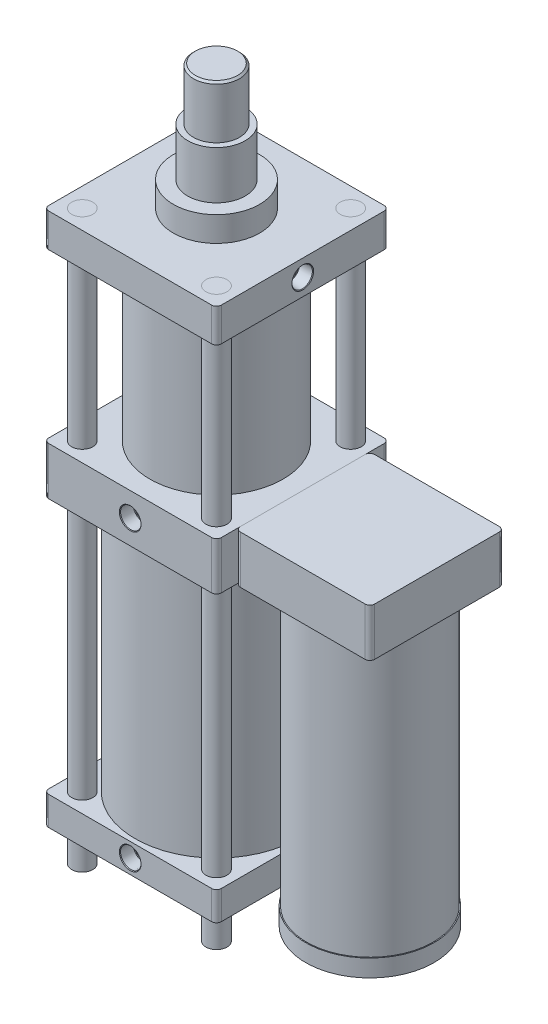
SolidWorks part; units mm, degrees
ref_plane "前视基准面" through (0, 0, 0) normal (0, 0, 1) x (1, 0, 0)
ref_plane "上视基准面" through (0, 0, 0) normal (0, 1, 0) x (1, 0, 0)
ref_plane "右视基准面" through (0, 0, 0) normal (1, 0, 0) x (0, 0, -1)
sketch "草图1" plane through (0, 0, 0) normal (0, 1, 0) x (1, 0, 0)
  line L0 (0, 0) -> (70, 0) construction
  line L1 (85, 90) -> (-85, 90)
  line L2 (90, 85) -> (90, -85)
  line L3 (85, -90) -> (-85, -90)
  line L4 (-90, 85) -> (-90, -85)
  line L5 (90, 90) -> (-90, -90) construction
  line L6 (90, -90) -> (-90, 90) construction
  line L7 (70, 0) -> (70, -70) construction
  circle A0 centre (70, -70) radius 11
  circle A1 centre (-70, -70) radius 11
  circle A2 centre (-70, 70) radius 11
  circle A3 centre (70, 70) radius 11
  arc A4 (-90, -85) -> (-85, -90) centre (-85, -85) ccw
  arc A5 (90, -85) -> (85, -90) centre (85, -85) cw
  arc A6 (85, 90) -> (90, 85) centre (85, 85) cw
  arc A7 (-90, 85) -> (-85, 90) centre (-85, 85) cw
  point P0 (0, 0)
  point P19 (0, 0)
  dimension "D3" = 4
  dimension "D4" = 5
  dimension "D1" = 180
  dimension "D2" = 180
extrude "凸台-拉伸1" add sketch "草图1" along normal blind 35
sketch "草图2" plane through (0, 35, 0) normal (0, 1, 0) x (1, 0, 0)
  circle A0 centre (0, 0) radius 45
extrude "凸台-拉伸2" add sketch "草图2" along normal blind 26
sketch "草图3" plane through (0, 61, 0) normal (0, 1, 0) x (1, 0, 0)
  circle A0 centre (0, 0) radius 30
extrude "凸台-拉伸3" add sketch "草图3" along normal blind 50
sketch "草图4" plane through (0, 111, 0) normal (0, 1, 0) x (1, 0, 0)
  circle A0 centre (0, 0) radius 24
extrude "凸台-拉伸4" add sketch "草图4" along normal blind 55
chamfer "倒角1" distance 2 angle 45 1 edges at (0, 166, 24)
sketch "草图5" plane through (0, 0, 0) normal (0, -1, 0) x (1, 0, 0)
  circle A0 centre (0, 0) radius 69.5
extrude "凸台-拉伸5" add sketch "草图5" along normal blind 175 separate body
sketch "草图6" plane through (0, -175, 0) normal (0, -1, 0) x (1, 0, 0)
  line L0 (85, -90) -> (-85, -90) construction
  line L1 (90, 85) -> (90, -85) construction
  line L2 (-90, -85) -> (-90, 85) construction
  line L3 (-85, 90) -> (85, 90) construction
  line L4 (85, -90) -> (-85, -90)
  line L5 (90, 85) -> (90, -85)
  line L6 (-90, -85) -> (-90, 85)
  line L7 (-85, 90) -> (85, 90)
  circle A0 centre (70, -70) radius 11 construction
  circle A1 centre (-70, -70) radius 11 construction
  arc A2 (-90, -85) -> (-85, -90) centre (-85, -85) ccw construction
  arc A3 (85, -90) -> (90, -85) centre (85, -85) ccw construction
  arc A4 (90, 85) -> (85, 90) centre (85, 85) ccw construction
  circle A5 centre (70, 70) radius 11 construction
  circle A6 centre (-70, 70) radius 11 construction
  arc A7 (-85, 90) -> (-90, 85) centre (-85, 85) ccw construction
  circle A8 centre (70, -70) radius 11
  circle A9 centre (-70, -70) radius 11
  arc A10 (-90, -85) -> (-85, -90) centre (-85, -85) ccw
  arc A11 (85, -90) -> (90, -85) centre (85, -85) ccw
  arc A12 (90, 85) -> (85, 90) centre (85, 85) ccw
  circle A13 centre (70, 70) radius 11
  circle A14 centre (-70, 70) radius 11
  arc A15 (-85, 90) -> (-90, 85) centre (-85, 85) ccw
extrude "凸台-拉伸6" add sketch "草图6" along normal blind 50
sketch "草图7" plane through (0, -225, 0) normal (0, -1, 0) x (1, 0, 0)
  circle A0 centre (0, 0) radius 85
extrude "凸台-拉伸7" add sketch "草图7" along normal blind 267
sketch "草图8" plane through (0, -492, 0) normal (0, -1, 0) x (1, 0, 0)
  line L0 (-85, -90) -> (85, -90) construction
  line L1 (90, -85) -> (90, 85) construction
  line L2 (85, 90) -> (-85, 90) construction
  line L3 (-90, 85) -> (-90, -85) construction
  line L4 (-85, -90) -> (85, -90)
  line L5 (90, -85) -> (90, 85)
  line L6 (85, 90) -> (-85, 90)
  line L7 (-90, 85) -> (-90, -85)
  circle A0 centre (-70, -70) radius 11 construction
  arc A1 (-90, -85) -> (-85, -90) centre (-85, -85) ccw construction
  circle A2 centre (70, -70) radius 11 construction
  arc A3 (85, -90) -> (90, -85) centre (85, -85) ccw construction
  arc A4 (90, 85) -> (85, 90) centre (85, 85) ccw construction
  circle A5 centre (70, 70) radius 11 construction
  arc A6 (-85, 90) -> (-90, 85) centre (-85, 85) ccw construction
  circle A7 centre (-70, 70) radius 11 construction
  circle A8 centre (-70, -70) radius 11
  arc A9 (-90, -85) -> (-85, -90) centre (-85, -85) ccw
  circle A10 centre (70, -70) radius 11
  arc A11 (85, -90) -> (90, -85) centre (85, -85) ccw
  arc A12 (90, 85) -> (85, 90) centre (85, 85) ccw
  circle A13 centre (70, 70) radius 11
  arc A14 (-85, 90) -> (-90, 85) centre (-85, 85) ccw
  circle A15 centre (-70, 70) radius 11
extrude "凸台-拉伸8" add sketch "草图8" along normal blind 30
sketch "草图9" plane through (0, -175, 0) normal (0, 1, 0) x (1, 0, 0)
  line L0 (90, 0) -> (160, 0) construction
  line L1 (90, 85) -> (90, -85) construction
  line L3 (225, -70) -> (95, -70)
  line L4 (230, -65) -> (230, 65)
  line L5 (225, 70) -> (95, 70)
  line L6 (90, -65) -> (90, 65)
  line L7 (230, -70) -> (90, 70) construction
  line L8 (230, 70) -> (90, -70) construction
  arc A0 (95, 70) -> (90, 65) centre (95, 65) ccw
  arc A1 (95, -70) -> (90, -65) centre (95, -65) cw
  arc A2 (230, -65) -> (225, -70) centre (225, -65) cw
  arc A3 (230, 65) -> (225, 70) centre (225, 65) ccw
  dimension "D3" = 5
  dimension "D1" = 140
  dimension "D2" = 140
extrude "凸台-拉伸9" add sketch "草图9" against normal up to surface (50 mm away) separate body
sketch "草图10" plane through (0, -225, 0) normal (0, -1, 0) x (1, 0, 0)
  line L0 (160, 70) -> (160, -70) construction
  line L1 (95, 70) -> (225, 70) construction
  circle A0 centre (160, 0) radius 66
extrude "凸台-拉伸10" add sketch "草图10" along normal blind 290 separate body
sketch "草图11" plane through (0, -515, 0) normal (0, -1, 0) x (1, 0, 0)
  circle A0 centre (160, 0) radius 67
extrude "凸台-拉伸11" add sketch "草图11" along normal blind 18 separate body
sketch "草图12" plane through (0, -533, 0) normal (0, -1, 0) x (1, 0, 0)
  line L1 (177.3205, 0) -> (168.6603, 15)
  line L2 (168.6603, 15) -> (151.3397, 15)
  line L3 (151.3397, 15) -> (142.6795, 0)
  line L4 (142.6795, 0) -> (151.3397, -15)
  line L5 (151.3397, -15) -> (168.6603, -15)
  line L6 (168.6603, -15) -> (177.3205, 0)
  circle A0 centre (160, 0) radius 15 construction
extrude "凸台-拉伸12" add sketch "草图12" along normal blind 12 separate body
sketch "草图13" plane through (0, -522, 0) normal (0, -1, 0) x (1, 0, 0)
  circle A0 centre (-70, -70) radius 11 construction
  circle A1 centre (-70, 70) radius 11 construction
  circle A2 centre (70, -70) radius 11 construction
  circle A3 centre (70, 70) radius 11 construction
  circle A4 centre (-70, -70) radius 11
  circle A5 centre (-70, 70) radius 11
  circle A6 centre (70, -70) radius 11
  circle A7 centre (70, 70) radius 11
extrude "凸台-拉伸13" add sketch "草图13" against normal up to surface (557 mm away) and the other way blind 35 separate body
hole_wizard "1/2 NPT 螺纹孔1" positions "草图14" profile "草图15" size "1/2" standard "ANSI Inch"
sketch "草图14" plane through (90, 0, 0) normal (1, 0, 0) x (0, 0, -1)
  line L0 (-85, 35) -> (85, 35) construction
  point P0 (0, 17.5)
  dimension "D1" = 17.5
sketch "草图15" plane through (90, 17.5, 0) normal (0, 1, 0) x (0, 0, -1)
  line L0 (0, 0) -> (0, 28.0045)
  line L1 (8.9281, 22.64) -> (0, 28.0045)
  line L2 (-8.9281, 22.64) -> (0, 28.0045) construction
  line L3 (8.9281, 22.64) -> (8.9281, 13.57)
  line L4 (8.9281, 13.57) -> (10.2807, 13.57)
  line L5 (10.2807, 13.57) -> (10.668, 0.635)
  line L6 (10.668, 0.635) -> (11.303, 0)
  line L7 (11.303, 0) -> (0, 0)
  line L8 (0, -6.35) -> (0, 107.95) construction
  line L9 (-10.668, 0.635) -> (-11.303, 0) construction
  line L11 (-8.9281, 13.57) -> (-10.2807, 13.57) construction
  line L12 (-10.2807, 13.57) -> (-10.668, 0.635) construction
  dimension "螺纹孔钻头直径" = 17.8562
  dimension "螺纹孔钻头深度" = 22.64
  dimension "螺纹直径" = 21.3359
  dimension "螺纹角度" = 3.43
  dimension "螺纹深度" = 13.57
  dimension "锥形沉头孔直径" = 22.6059
  dimension "锥形沉头孔角度" = 90
  dimension "导头角度" = 118
hole_wizard "1/2 NPT 螺纹孔2" positions "草图16" profile "草图17" size "1/2" standard "ANSI Inch"
sketch "草图16" plane through (0, 0, 90) normal (0, 0, 1) x (1, 0, 0)
  line L0 (85, -225) -> (-85, -225) construction
  line L1 (85, -492) -> (-85, -492) construction
  point P0 (0, -200)
  point P2 (0, -507)
  dimension "D1" = 25
  dimension "D2" = 15
sketch "草图17" plane through (0, -200, 90) normal (1, 0, 0) x (0, -1, 0)
  line L0 (0, 0) -> (0, 28.0045)
  line L1 (8.9281, 22.64) -> (0, 28.0045)
  line L2 (-8.9281, 22.64) -> (0, 28.0045) construction
  line L3 (8.9281, 22.64) -> (8.9281, 13.57)
  line L4 (8.9281, 13.57) -> (10.2807, 13.57)
  line L5 (10.2807, 13.57) -> (10.668, 0.635)
  line L6 (10.668, 0.635) -> (11.303, 0)
  line L7 (11.303, 0) -> (0, 0)
  line L8 (0, -6.35) -> (0, 107.95) construction
  line L9 (-10.668, 0.635) -> (-11.303, 0) construction
  line L11 (-8.9281, 13.57) -> (-10.2807, 13.57) construction
  line L12 (-10.2807, 13.57) -> (-10.668, 0.635) construction
  dimension "螺纹孔钻头直径" = 17.8562
  dimension "螺纹孔钻头深度" = 22.64
  dimension "螺纹直径" = 21.3359
  dimension "螺纹角度" = 3.43
  dimension "螺纹深度" = 13.57
  dimension "锥形沉头孔直径" = 22.6059
  dimension "锥形沉头孔角度" = 90
  dimension "导头角度" = 118
hole_wizard "1/2 NPT 螺纹孔3" positions "草图18" profile "草图19" size "1/2" standard "ANSI Inch"
sketch "草图18" plane through (0, -545, 0) normal (0, -1, 0) x (-1, 0, 0)
  line L0 (-177.3205, 0) -> (-168.6603, -15) construction
  line L1 (-168.6603, 15) -> (-177.3205, 0) construction
  point P0 (-160, 0)
  dimension "D1" = 15
  dimension "D2" = 15
sketch "草图19" plane through (160, -545, 0) normal (1, 0, 0) x (0, 0, -1)
  line L0 (0, 0) -> (0, 28.0045)
  line L1 (8.9281, 22.64) -> (0, 28.0045)
  line L2 (-8.9281, 22.64) -> (0, 28.0045) construction
  line L3 (8.9281, 22.64) -> (8.9281, 13.57)
  line L4 (8.9281, 13.57) -> (10.2807, 13.57)
  line L5 (10.2807, 13.57) -> (10.668, 0.635)
  line L6 (10.668, 0.635) -> (11.303, 0)
  line L7 (11.303, 0) -> (0, 0)
  line L8 (0, -6.35) -> (0, 107.95) construction
  line L9 (-10.668, 0.635) -> (-11.303, 0) construction
  line L11 (-8.9281, 13.57) -> (-10.2807, 13.57) construction
  line L12 (-10.2807, 13.57) -> (-10.668, 0.635) construction
  dimension "螺纹孔钻头直径" = 17.8562
  dimension "螺纹孔钻头深度" = 22.64
  dimension "螺纹直径" = 21.3359
  dimension "螺纹角度" = 3.43
  dimension "螺纹深度" = 13.57
  dimension "锥形沉头孔直径" = 22.6059
  dimension "锥形沉头孔角度" = 90
  dimension "导头角度" = 118
hole_wizard "1/4 NPT 螺纹孔1" positions "草图20" profile "草图21" size "1/4" standard "ANSI Inch"
sketch "草图20" plane through (-90, 0, 0) normal (-1, 0, 0) x (0, 0, 1)
  line L0 (85, -175) -> (-85, -175) construction
  point P0 (0, -200)
  dimension "D1" = 25
sketch "草图21" plane through (-90, -200, 0) normal (0, 1, 0) x (0, 0, 1)
  line L0 (0, 0) -> (0, 20.4123)
  line L1 (5.5626, 17.07) -> (0, 20.4123)
  line L2 (-5.5626, 17.07) -> (0, 20.4123) construction
  line L3 (5.5626, 17.07) -> (5.5626, 10.02)
  line L4 (5.5626, 10.02) -> (6.577, 10.02)
  line L5 (6.577, 10.02) -> (6.858, 0.635)
  line L6 (6.858, 0.635) -> (7.493, 0)
  line L7 (7.493, 0) -> (0, 0)
  line L8 (0, -6.35) -> (0, 107.95) construction
  line L9 (-6.858, 0.635) -> (-7.493, 0) construction
  line L11 (-5.5626, 10.02) -> (-6.577, 10.02) construction
  line L12 (-6.577, 10.02) -> (-6.858, 0.635) construction
  dimension "螺纹孔钻头直径" = 11.1252
  dimension "螺纹孔钻头深度" = 17.07
  dimension "螺纹直径" = 13.716
  dimension "螺纹角度" = 3.43
  dimension "螺纹深度" = 10.02
  dimension "锥形沉头孔直径" = 14.986
  dimension "锥形沉头孔角度" = 90
  dimension "导头角度" = 118
hole_wizard "1/4 NPT 螺纹孔2" positions "草图22" profile "草图23" size "1/4" standard "ANSI Inch"
sketch "草图22" plane through (0, 0, -90) normal (0, 0, -1) x (-1, 0, 0)
  line L0 (85, -175) -> (-85, -175) construction
  point P0 (0, -200)
  dimension "D1" = 25
sketch "草图23" plane through (0, -200, -90) normal (1, 0, 0) x (0, 1, 0)
  line L0 (0, 0) -> (0, 20.4123)
  line L1 (5.5626, 17.07) -> (0, 20.4123)
  line L2 (-5.5626, 17.07) -> (0, 20.4123) construction
  line L3 (5.5626, 17.07) -> (5.5626, 10.02)
  line L4 (5.5626, 10.02) -> (6.577, 10.02)
  line L5 (6.577, 10.02) -> (6.858, 0.635)
  line L6 (6.858, 0.635) -> (7.493, 0)
  line L7 (7.493, 0) -> (0, 0)
  line L8 (0, -6.35) -> (0, 107.95) construction
  line L9 (-6.858, 0.635) -> (-7.493, 0) construction
  line L11 (-5.5626, 10.02) -> (-6.577, 10.02) construction
  line L12 (-6.577, 10.02) -> (-6.858, 0.635) construction
  dimension "螺纹孔钻头直径" = 11.1252
  dimension "螺纹孔钻头深度" = 17.07
  dimension "螺纹直径" = 13.716
  dimension "螺纹角度" = 3.43
  dimension "螺纹深度" = 10.02
  dimension "锥形沉头孔直径" = 14.986
  dimension "锥形沉头孔角度" = 90
  dimension "导头角度" = 118
